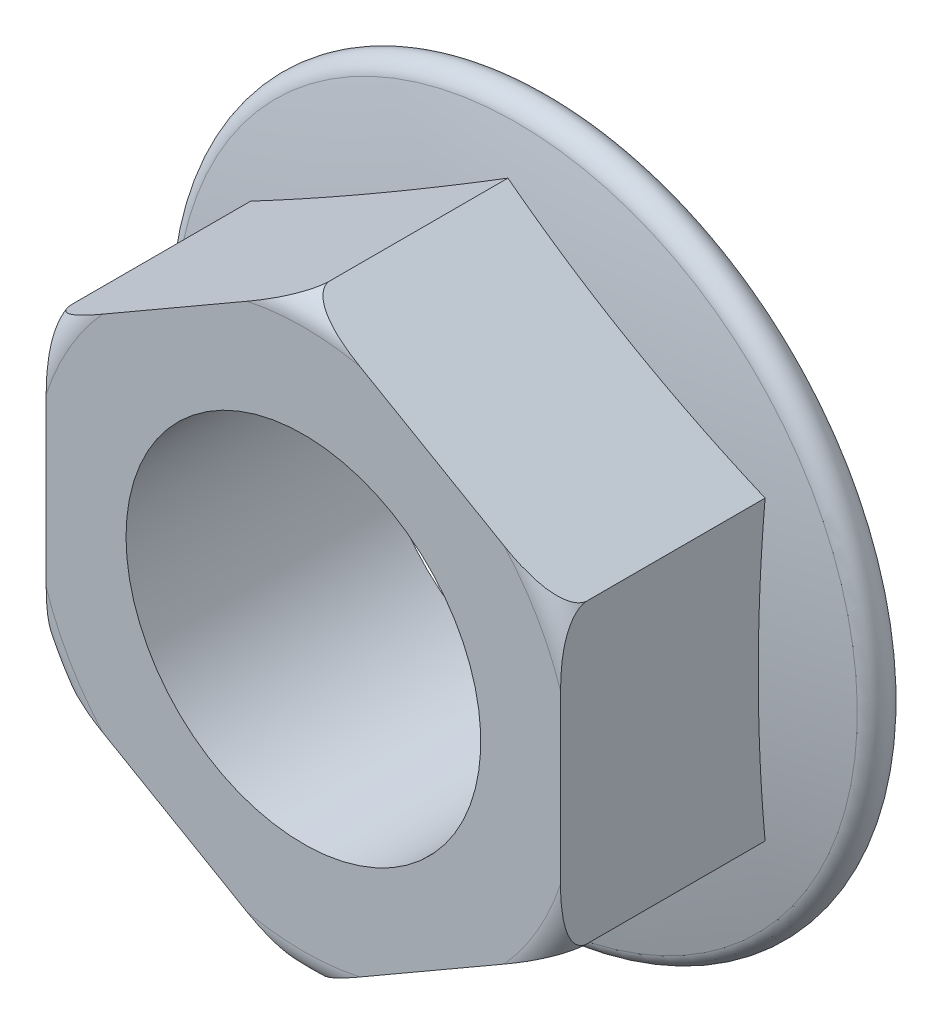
SolidWorks part; units mm, degrees
extrude "Head" add sketch "Head Sketch" along normal blind 28
sketch "Head Sketch" plane through (0, 0, 0) normal (0, 0, 1) x (1, 0, 0)
  line L0 (0, 33.4863) -> (29, 16.7432)
  line L1 (29, 16.7432) -> (29, -16.7432)
  line L2 (29, -16.7432) -> (0, -33.4863)
  line L3 (0, -33.4863) -> (-29, -16.7432)
  line L4 (-29, -16.7432) -> (-29, 16.7432)
  line L5 (-29, 16.7432) -> (0, 33.4863)
  line L6 (29, 16.7432) -> (-29, -16.7432) construction
  line L7 (0, 33.4863) -> (0, -33.4863) construction
  line L8 (-29, 16.7432) -> (29, -16.7432) construction
  point P0 (0, 0)
  dimension "D1" = 60
  dimension "D2" = 60
  dimension "Flats" = 58
revolve "Flange" add sketch "Flange Sketch" angle 360 about L0
sketch "Flange Sketch" plane through (0, 0, 0) normal (0, 1, 0) x (-1, 0, 0)
  line L0 (0, 1.8434) -> (0, 8) construction
  line L1 (-38, 0) -> (0, 0)
  line L2 (0, 50) -> (0, -50) construction
  line L4 (0, 0) -> (0, 8)
  line L5 (0, 0) -> (-29, 0) construction
  arc A0 (0, 8) -> (-38.4164, 3.9562) centre (0, -176.5) ccw
  arc A1 (-38, 0) -> (-38.4164, 3.9562) centre (-38, 2) cw
  dimension "D1" = 2
  dimension "D3" = 76
  dimension "Flange Height" = 8
ref_plane "Plane1" through (0, 0, 0) normal (0, 0, 1) x (1, 0, 0)
ref_plane "Plane2" through (0, 0, 0) normal (0, 1, 0) x (-1, 0, 0)
ref_plane "Plane3" through (0, 0, 0) normal (1, 0, 0) x (0, 0, -1)
sketch "Sketch5" plane through (0, 0, 0) normal (1, 0, 0) x (0, 0, -1)
  line L0 (-28, -30.4863) -> (-28, -33.4863)
  line L1 (-28, -33.4863) -> (-25, -33.4863)
  line L2 (-28, -33.4863) -> (-4.9357, -33.4863) construction
  line L3 (-28, -33.4863) -> (-28, -16.7432) construction
  line L5 (-15.0856, 0) -> (-8.1394, 0) construction
  line L6 (50, 0) -> (-50, 0) construction
  arc A0 (-28, -30.4863) -> (-25, -33.4863) centre (-25, -30.4863) ccw
  dimension "D1" = 3
revolve "Head Trim" cut sketch "Sketch5" angle 360 about L5
sketch "Esquisse1" plane through (0, 0, 0) normal (0, 0, -1) x (-1, 0, 0)
  circle A0 centre (0, 0) radius 20
  dimension "D1" = 40
extrude "Enlèv. mat.-Extru.1" cut sketch "Esquisse1" against normal through all
